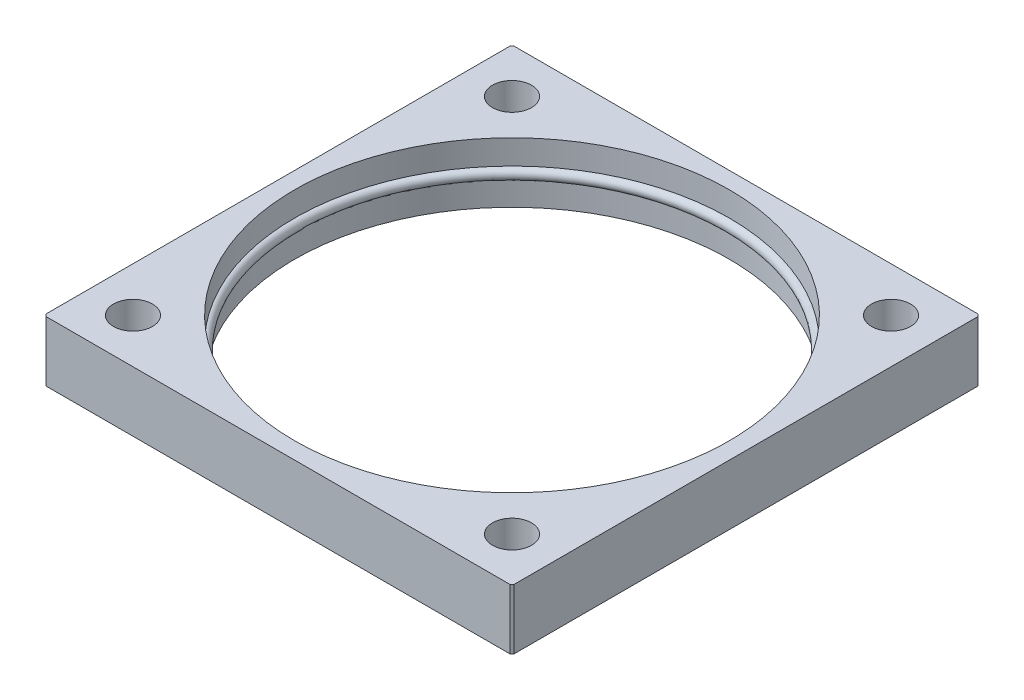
SolidWorks part; units mm, degrees
ref_plane "Front Plane" through (0, 0, 0) normal (0, 0, 1) x (1, 0, 0)
ref_plane "Top Plane" through (0, 0, 0) normal (0, 1, 0) x (1, 0, 0)
ref_plane "Right Plane" through (0, 0, 0) normal (1, 0, 0) x (0, 0, -1)
sketch "Sketch1" plane through (0, 0, 0) normal (0, 1, 0) x (1, 0, 0)
  line L0 (-105, 104) -> (-104, 105)
  line L1 (-104, -105) -> (104, -105)
  line L2 (-105, -104) -> (-105, 104)
  line L3 (-104, 105) -> (104, 105)
  line L4 (105, -104) -> (105, 104)
  line L5 (-105, -105) -> (105, 105) construction
  line L6 (-105, 105) -> (105, -105) construction
  line L7 (104, 105) -> (105, 104)
  line L8 (104, -105) -> (105, -104)
  line L9 (-104, -105) -> (-105, -104)
  line L10 (-85, 85) -> (-85, -85) construction
  line L15 (-85, -85) -> (85, -85) construction
  line L16 (85, -85) -> (85, 85) construction
  line L17 (85, 85) -> (-85, 85) construction
  circle A0 centre (0, 0) radius 97.5
  circle A1 centre (-85, 85) radius 8.75
  circle A2 centre (85, 85) radius 8.75
  circle A3 centre (85, -85) radius 8.75
  circle A4 centre (-85, -85) radius 8.75
  point P0 (0, 0)
  dimension "D2" = 195
  dimension "D4" = 17.5
  dimension "D1" = 210
  dimension "D3" = 170
extrude "Boss-Extrude1" add sketch "Sketch1" along normal mid plane 27
sketch "Sketch2" plane through (0, 0, 0) normal (0, 0, 1) x (1, 0, 0)
  line L0 (-97.5, 0) -> (0, 0) construction
  line L1 (0, 0) -> (0, 13.5) construction
  line L2 (-104, 13.5) -> (104, 13.5) construction
  circle A0 centre (-97.5, 0) radius 2.5
  dimension "D1" = 5
  dimension "D2" = 195
revolve "Revolve1" add sketch "Sketch2" angle 360 about L1
